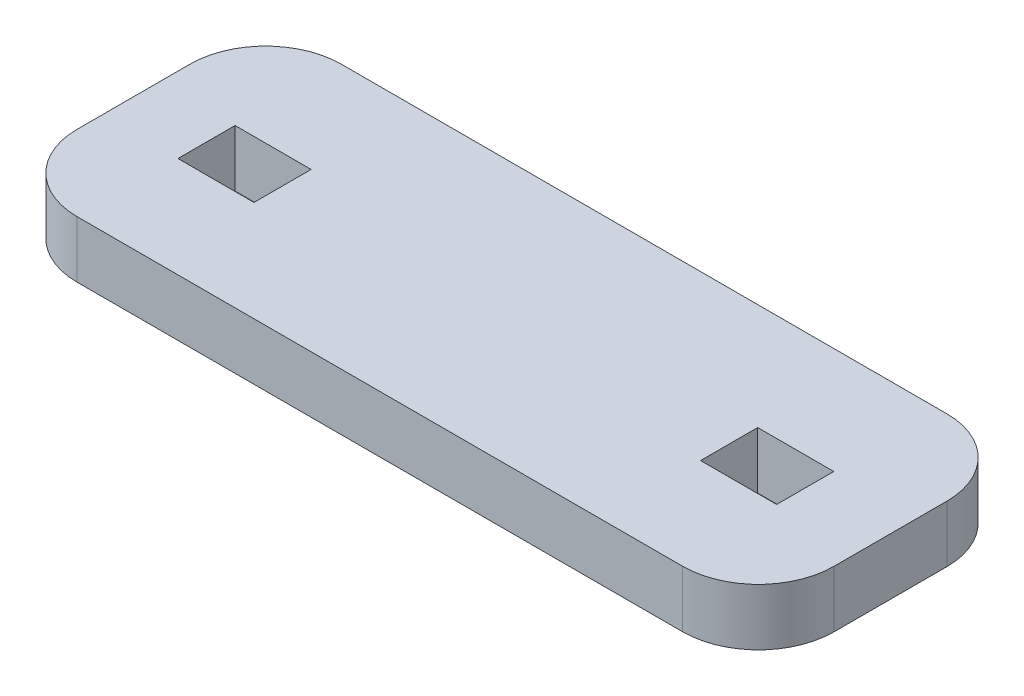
SolidWorks part; units mm, degrees
ref_plane "Front Plane" through (0, 0, 0) normal (0, 0, 1) x (1, 0, 0)
ref_plane "Top Plane" through (0, 0, 0) normal (0, 1, 0) x (1, 0, 0)
ref_plane "Right Plane" through (0, 0, 0) normal (1, 0, 0) x (0, 0, -1)
sketch "Sketch1" plane through (0, 0, 0) normal (0, 1, 0) x (1, 0, 0)
  line L0 (210.9969, 24.596) -> (231.0969, 24.596)
  line L1 (72.8311, 52.7378) -> (232.8311, 52.7378)
  line L2 (52.8311, 32.7378) -> (52.8311, 2.9378)
  line L3 (72.8311, -17.0622) -> (232.8311, -17.0622)
  line L4 (252.8311, 32.7378) -> (252.8311, 2.9378)
  line L5 (72.8311, 24.6642) -> (92.9311, 24.6642)
  line L6 (72.8311, 24.6642) -> (72.8311, 9.5642)
  line L7 (72.8311, 9.5642) -> (92.9311, 9.5642)
  line L8 (92.9311, 24.6642) -> (92.9311, 9.5642)
  line L9 (210.9969, 24.596) -> (210.9969, 9.496)
  line L10 (210.9969, 9.496) -> (231.0969, 9.496)
  line L11 (231.0969, 24.596) -> (231.0969, 9.496)
  arc A0 (232.8311, 52.7378) -> (252.8311, 32.7378) centre (232.8311, 32.7378) cw
  arc A1 (232.8311, -17.0622) -> (252.8311, 2.9378) centre (232.8311, 2.9378) ccw
  arc A2 (52.8311, 2.9378) -> (72.8311, -17.0622) centre (72.8311, 2.9378) ccw
  arc A3 (72.8311, 52.7378) -> (52.8311, 32.7378) centre (72.8311, 32.7378) ccw
  point P6 (252.8311, 52.7378)
  point P9 (252.8311, -17.0622)
  point P14 (52.8311, 52.7378)
  dimension "D3" = 20
  dimension "D4" = 20
  dimension "D5" = 20
  dimension "D6" = 20
  dimension "D1" = 69.8
  dimension "D2" = 200
  dimension "D7" = 15.1
  dimension "D8" = 20.1
  dimension "D9" = 15.1
  dimension "D10" = 20.1
extrude "Boss-Extrude1" add sketch "Sketch1" along normal mid plane 15
